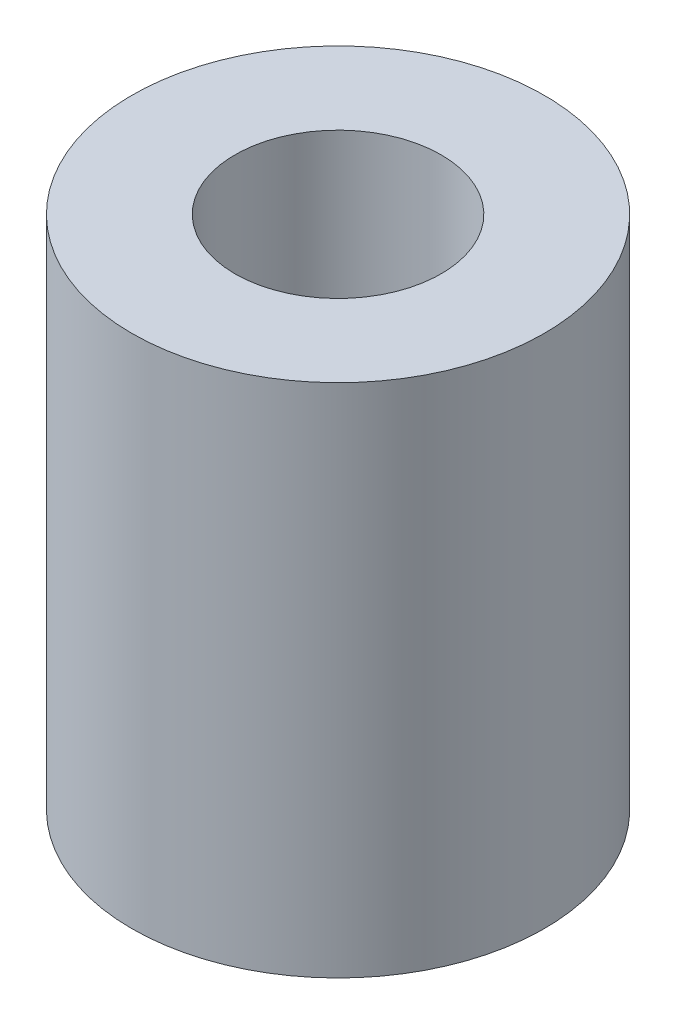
SolidWorks part; units mm, degrees
ref_plane "前视基准面" through (0, 0, 0) normal (0, 0, 1) x (1, 0, 0)
ref_plane "上视基准面" through (0, 0, 0) normal (0, 1, 0) x (1, 0, 0)
ref_plane "右视基准面" through (0, 0, 0) normal (1, 0, 0) x (0, 0, -1)
other "Configuration Table"
sketch "草图1" plane through (0, 0, 0) normal (0, 1, 0) x (1, 0, 0)
  circle A0 centre (0, 0) radius 16
  dimension "D1" = 32
extrude "凸台-拉伸1" add sketch "草图1" along normal blind 40
sketch "草图2" plane through (0, 40, 0) normal (0, 1, 0) x (1, 0, 0)
  circle A0 centre (0, 0) radius 8
  dimension "D1" = 16
extrude "切除-拉伸1" cut sketch "草图2" against normal blind 20
sketch "草图3" plane through (0, 0, 0) normal (0, -1, 0) x (1, 0, 0)
  circle A0 centre (0, 0) radius 4
  dimension "D1" = 8
extrude "切除-拉伸2" cut sketch "草图3" against normal blind 20
